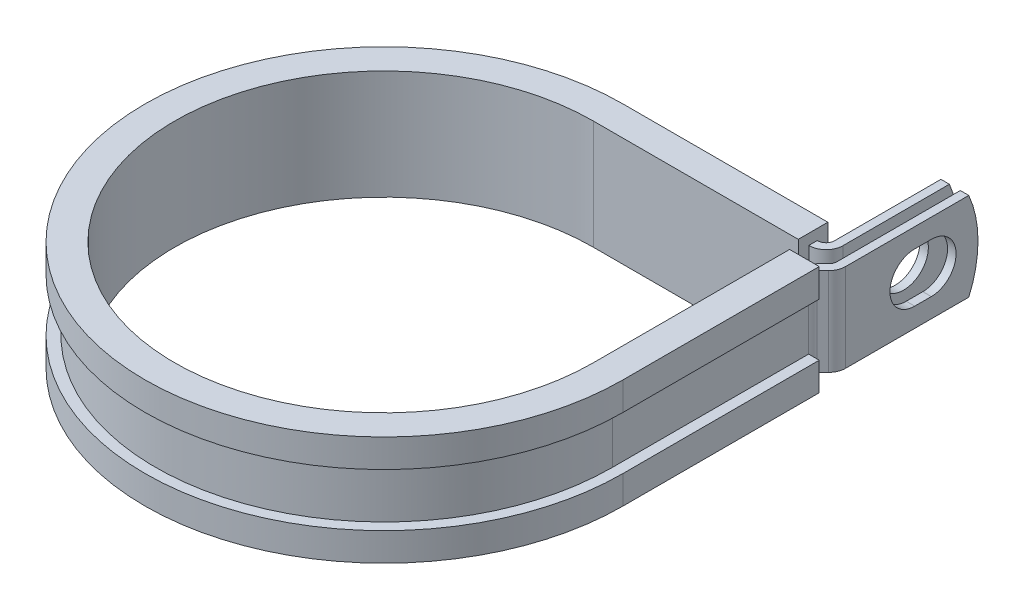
SolidWorks part; units mm, degrees
ref_plane "Front Plane" through (0, 0, 0) normal (0, 0, 1) x (1, 0, 0)
ref_plane "Top Plane" through (0, 0, 0) normal (0, 1, 0) x (1, 0, 0)
ref_plane "Right Plane" through (0, 0, 0) normal (1, 0, 0) x (0, 0, -1)
sketch "Sketch1" plane through (0, 0, 0) normal (0, 1, 0) x (1, 0, 0)
  line L0 (0, 31.6865) -> (29.5708, 31.6865)
  line L1 (31.6865, 0) -> (31.6865, 28.274)
  line L2 (32.0092, 50.7746) -> (32.0092, 34.1249)
  line L3 (32.4007, 29.9982) -> (33.2269, 30.8244)
  line L5 (33.584, 31.6865) -> (33.584, 50.7746)
  arc A0 (0, 31.6865) -> (31.6865, 0) centre (0, 0) ccw
  arc A1 (32.4007, 29.9982) -> (31.6865, 28.274) centre (34.1249, 28.274) ccw
  arc A2 (33.2269, 30.8244) -> (33.584, 31.6865) centre (32.3648, 31.6865) ccw
  arc A3 (29.5708, 31.6865) -> (32.0092, 34.1249) centre (29.5708, 34.1249) ccw
extrude "Extrude-Thin1" add sketch "Sketch1" along normal mid plane 12.7 thin
sketch "Sketch2" plane through (30.79, 0, 0) normal (-1, 0, 0) x (0, 0, 1)
  line L0 (-50.7746, 6.35) -> (-50.7746, -6.35) construction
  line L1 (0, 6.35) -> (0, -6.35) construction
  circle A0 centre (-42.8498, 0) radius 3.5687
  point P2 (-50.7746, 0)
extrude "Cut-Extrude1" cut sketch "Sketch2" against normal up to surface (1.2192 mm away)
sketch "Sketch3" plane through (34.8032, 0, 0) normal (1, 0, 0) x (0, 0, -1)
  line L0 (41.656, 0) -> (44.0436, 0) construction
  line L1 (41.656, 3.5687) -> (44.0436, 3.5687)
  line L2 (41.656, -3.5687) -> (44.0436, -3.5687)
  line L3 (50.7746, 6.35) -> (50.7746, -6.35) construction
  arc A0 (41.656, 3.5687) -> (41.656, -3.5687) centre (41.656, 0) ccw
  arc A1 (44.0436, -3.5687) -> (44.0436, 3.5687) centre (44.0436, 0) ccw
  point P3 (42.8498, 0)
  point P8 (50.7746, 0)
  point P11 (38.0873, 0)
  point P12 (47.6123, 0)
extrude "Cut-Extrude2" cut sketch "Sketch3" against normal up to surface (1.2192 mm away)
sketch "Sketch4" plane through (30.79, 0, 0) normal (-1, 0, 0) x (0, 0, 1)
  line L0 (-50.7746, 6.35) -> (-50.7746, -6.35)
  line L1 (-50.7746, 6.35) -> (-49.4493, 6.35)
  line L2 (-50.7746, 6.35) -> (-34.1249, 6.35) construction
  line L3 (-50.7746, -6.35) -> (-49.4493, -6.35)
  line L4 (-50.7746, -6.35) -> (-34.1249, -6.35) construction
  arc A0 (-49.4493, 6.35) -> (-49.4493, -6.35) centre (-34.8996, 0) ccw
extrude "Cut-Extrude3" cut sketch "Sketch4" against normal through all contours A0 M4 M5 | A0 L0 M2
ref_plane "Plane1" through (0, 0, -28.274) normal (0, 0, -1) x (-1, 0, 0)
ref_plane "Plane2" through (29.52, 0, 0) normal (-1, 0, 0) x (0, 0, 1)
sketch "Sketch5" plane through (0, 0, -28.274) normal (0, 0, -1) x (-1, 0, 0)
  line L0 (-32.9057, 6.35) -> (-31.6865, 6.35)
  line L1 (-32.9057, 6.35) -> (-32.9057, -6.35) construction
  line L3 (-31.6865, 6.35) -> (-31.6865, -6.35)
  line L4 (-31.6865, -6.35) -> (-32.9057, -6.35)
  line L5 (-32.9057, -6.35) -> (-32.9057, -3.81)
  line L6 (-32.9057, 6.35) -> (-32.9057, 3.81)
  line L7 (-34.4297, 7.874) -> (-34.4297, 3.81)
  line L8 (-34.4297, 7.874) -> (-30.1625, 7.874)
  line L9 (-30.1625, 7.874) -> (-30.1625, -7.874)
  line L10 (-30.1625, -7.874) -> (-34.4297, -7.874)
  line L11 (-34.4297, -7.874) -> (-34.4297, -3.81)
  line L12 (-34.4297, 3.81) -> (-32.9057, 3.81)
  line L13 (-32.9057, -3.81) -> (-34.4297, -3.81)
sketch "Sketch6" plane through (0, 6.35, 0) normal (0, 1, 0) x (1, 0, 0)
  line L0 (30.1625, 0) -> (30.1625, 28.274)
  line L1 (30.1625, 28.274) -> (34.4297, 28.274) construction
  line L2 (29.52, 6.9878) -> (29.52, -6.9878) construction
  line L5 (0, 30.1625) -> (29.52, 30.1625)
  arc A0 (0, 30.1625) -> (30.1625, 0) centre (0, 0) ccw
sweep "Sweep1" add profiles "Sketch5" path "Sketch6"
equation "\"D4@Sketch5\" = \"D1@Extrude-Thin1\""
equation "\"D5@Sketch5\" = \"D5@Extrude-Thin1\""
equation "\"D1@Sketch3\" = \"D2@Sketch2\""
equation "\"D7@Sketch1\" = \"D3@Sketch2\" + \"D1@Sketch3\""
equation "\"D1@Sketch1\" = \"D1@Sketch6\" + 2 * \"D3@Sketch5\""
equation "\"D1@Sketch4\" = ( \"D1@Extrude-Thin1\" + .125 ) * 2"
equation "\"D9@Sketch1\"= \"D5@Extrude-Thin1\""
equation "\"D8@Sketch1\"= 2 * \"D5@Extrude-Thin1\""
equation "\"D2@Sketch1\" = 2 * \"D5@Extrude-Thin1\""
equation "\"D2@Sketch3\" = \"D1@Sketch2\""
